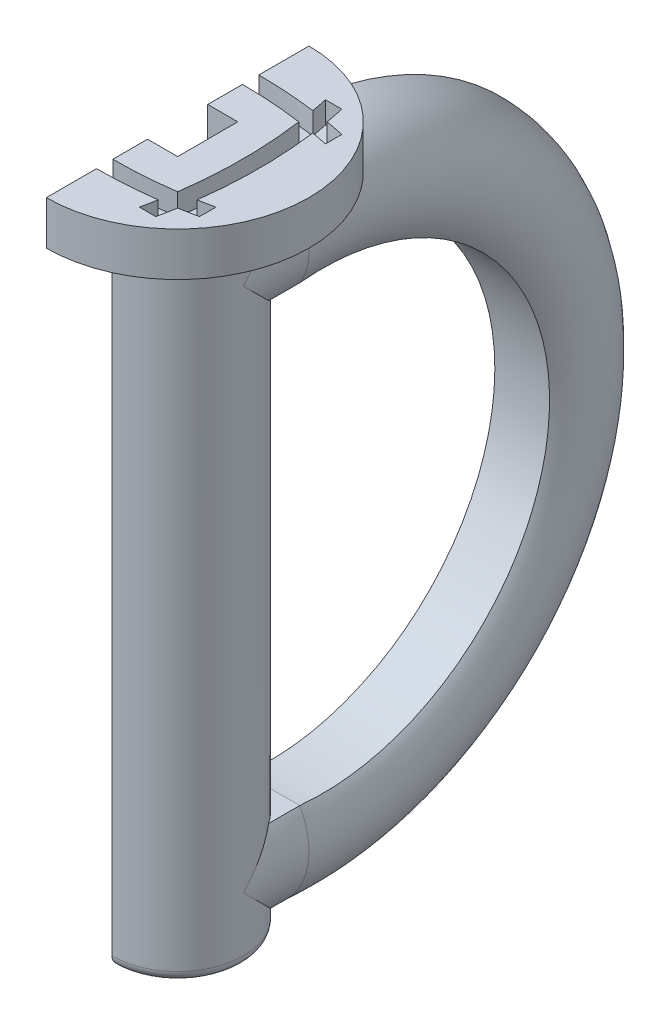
SolidWorks part; units mm, degrees
ref_plane "Front Plane" through (0, 0, 0) normal (0, 0, 1) x (1, 0, 0)
ref_plane "Top Plane" through (0, 0, 0) normal (0, 1, 0) x (1, 0, 0)
ref_plane "Right Plane" through (0, 0, 0) normal (1, 0, 0) x (0, 0, -1)
sketch "Sketch1" plane through (0, 0, 0) normal (0, 1, 0) x (1, 0, 0)
  circle A0 centre (0, 0) radius 24
  dimension "D1" = 48
extrude "Boss-Extrude1" add sketch "Sketch1" along normal blind 8
sketch "Sketch3" plane through (0, 8, 0) normal (0, 1, 0) x (1, 0, 0)
  line L0 (-5.5, 5.5) -> (5.5, 5.5)
  line L1 (5.5, 5.5) -> (5.5, -5.5)
  line L2 (5.5, -5.5) -> (-5.5, -5.5)
  line L3 (-5.5, -5.5) -> (-5.5, 5.5)
  dimension "D1" = 11
  dimension "D2" = 5.5
  dimension "D3" = 11
  dimension "D4" = 5.5
extrude "Cut-Extrude2" cut sketch "Sketch3" against normal blind 5.5
sketch "Sketch10" plane through (0, 8, 0) normal (0, 1, 0) x (1, 0, 0)
  line L1 (-17, 13) -> (-17, 10)
  line L3 (17, 10) -> (17, 13)
  line L4 (10, -17) -> (13, -17)
  line L5 (13, 17) -> (10, 17)
  line L7 (-17, -10) -> (-17, -13)
  line L8 (17, -13) -> (17, -10)
  line L10 (-10, 17) -> (-13, 17)
  line L11 (-13, -17) -> (-10, -17)
  arc A0 (-17, 13) -> (-13.6534, 13.6534) centre (0, -65.1729) cw
  arc A1 (-17, 10) -> (-14.125, 10.5759) centre (0, -67.4053) cw
  arc A2 (10, 17) -> (10.5759, 14.125) centre (-67.4053, 0) cw
  arc A3 (13, 17) -> (13.6534, 13.6534) centre (-65.1729, 0) cw
  arc A4 (17, -10) -> (14.125, -10.5759) centre (0, 67.4053) cw
  arc A5 (17, -13) -> (13.6534, -13.6534) centre (0, 65.1729) cw
  arc A6 (-10, -17) -> (-10.5759, -14.125) centre (67.4053, 0) cw
  arc A7 (-13, -17) -> (-13.6534, -13.6534) centre (65.1729, 0) cw
  arc A8 (-10.5759, 14.125) -> (-10, 17) centre (67.4053, 0) cw
  arc A9 (-13.6534, 13.6534) -> (-13, 17) centre (65.1729, 0) cw
  arc A10 (-11.0681, 11.0681) -> (11.0681, 11.0681) centre (0, -67.4053) cw
  arc A11 (-10.5759, 14.125) -> (10.5759, 14.125) centre (0, -65.1729) cw
  arc A12 (13.6534, 13.6534) -> (17, 13) centre (0, -65.1729) cw
  arc A13 (14.125, 10.5759) -> (17, 10) centre (0, -67.4053) cw
  arc A14 (11.0681, 11.0681) -> (11.0681, -11.0681) centre (-67.4053, 0) cw
  arc A15 (14.125, 10.5759) -> (14.125, -10.5759) centre (-65.1729, 0) cw
  arc A16 (13.6534, -13.6534) -> (13, -17) centre (-65.1729, 0) cw
  arc A17 (10.5759, -14.125) -> (10, -17) centre (-67.4053, 0) cw
  arc A18 (11.0681, -11.0681) -> (-11.0681, -11.0681) centre (0, 67.4053) cw
  arc A19 (10.5759, -14.125) -> (-10.5759, -14.125) centre (0, 65.1729) cw
  arc A20 (-13.6534, -13.6534) -> (-17, -13) centre (0, 65.1729) cw
  arc A21 (-14.125, -10.5759) -> (-14.125, 10.5759) centre (65.1729, 0) cw
  arc A22 (-14.125, -10.5759) -> (-17, -10) centre (0, 67.4053) cw
  arc A23 (-11.0681, -11.0681) -> (-11.0681, 11.0681) centre (67.4053, 0) cw
  point P36 (0, 0)
extrude "Cut-Extrude6" cut sketch "Sketch10" against normal blind 4
sketch "Sketch12" plane through (0, 0, 0) normal (0, 0, 1) x (1, 0, 0)
  line L0 (0, 0) -> (0, -120)
  line L1 (0, -120) -> (12, -120)
  line L2 (12, -120) -> (12, 0)
  line L3 (-24, 0) -> (24, 0) construction
  line L4 (12, 0) -> (0, 0)
  line L5 (0, 0) -> (0.3914, 0.2819)
  dimension "D1" = 12
  dimension "D2" = 120
revolve "Revolve4" add sketch "Sketch12" angle 360 about L0
sketch "Sketch13" plane through (0, 0, 0) normal (0, 0, 1) x (1, 0, 0)
  line L0 (-10, -18.6332) -> (10, -18.6332)
  arc A0 (10, -18.6332) -> (-10, -18.6332) centre (0, -12) ccw
  dimension "D1" = 24
  dimension "D2" = 20
sketch "Sketch14" plane through (0, 0, 0) normal (1, 0, 0) x (0, 0, -1)
  line L2 (0, -108) -> (12, -108)
  line L3 (0, -12) -> (12, -12)
  arc A0 (12, -108) -> (12, -12) centre (16.4021, -60) ccw
  dimension "D2" = 12
  dimension "D3" = 12
sweep "Sweep1" add profiles "Sketch13" path "Sketch14"
sketch "Sketch15" plane through (0, -120, 0) normal (0, -1, 0) x (1, 0, 0)
  line L0 (0, 0) -> (0, -90.1747)
  line L1 (0, 36.1347) -> (-34.967, 36.1347)
  line L2 (-34.967, 36.1347) -> (-34.967, -90.1747)
  line L3 (-34.967, -90.1747) -> (0, -90.1747)
  line L4 (0, 36.1347) -> (0, 0)
extrude "Cut-Extrude9" cut sketch "Sketch15" against normal through all
sketch "Sketch16" plane through (0, -120, 0) normal (0, 1, 0) x (1, 0, 0)
  line L0 (0, 11.4509) -> (0, 21.3994)
  line L1 (0, 21.3994) -> (0, 23.7276)
  line L2 (0, 23.7276) -> (-3.8367, 23.7276)
  line L3 (-3.8367, 23.7276) -> (-3.8367, 8.9693)
  line L4 (-3.8367, 8.9693) -> (0, 8.9693)
  line L5 (0, 11.8448) -> (0, 5.5) construction
  line L6 (0, 8.9693) -> (0, 11.4509)
extrude "Cut-Extrude10" cut sketch "Sketch16" against normal blind 10
sketch "Sketch17" plane through (0, 0, 0) normal (-1, 0, 0) x (0, 0, 1)
  line L0 (-5.5, -101.3668) -> (5.5, -101.3668)
  line L5 (-61.7703, -65.5) -> (-61.7703, -54.5)
  line L6 (-61.7703, -54.5) -> (-72.7703, -54.5)
  line L7 (-72.7703, -54.5) -> (-72.7703, -65.5)
  line L8 (-72.7703, -65.5) -> (-61.7703, -65.5)
  line L14 (5.5, -101.3668) -> (5.5, -90.3668)
  line L15 (5.5, -90.3668) -> (-5.5, -90.3668)
  line L16 (-5.5, -90.3668) -> (-5.5, -101.3668)
  line L17 (-5.5, -18.6332) -> (5.5, -18.6332)
  line L18 (5.5, -18.6332) -> (5.5, -29.6332)
  line L19 (5.5, -29.6332) -> (-5.5, -29.6332)
  line L20 (-5.5, -29.6332) -> (-5.5, -18.6332)
  dimension "D2" = 11
  dimension "D3" = 11
  dimension "D6" = 11
  dimension "D7" = 11
  dimension "D9" = 11
  dimension "D10" = 11
extrude "Cut-Extrude11" cut sketch "Sketch17" against normal blind 5.5
fillet "Fillet1" radius 2 1 edges at (11.9891, -120, 0.512)
equation "\"D2@Sketch10\"=\"D1@Sketch10\"/2"
